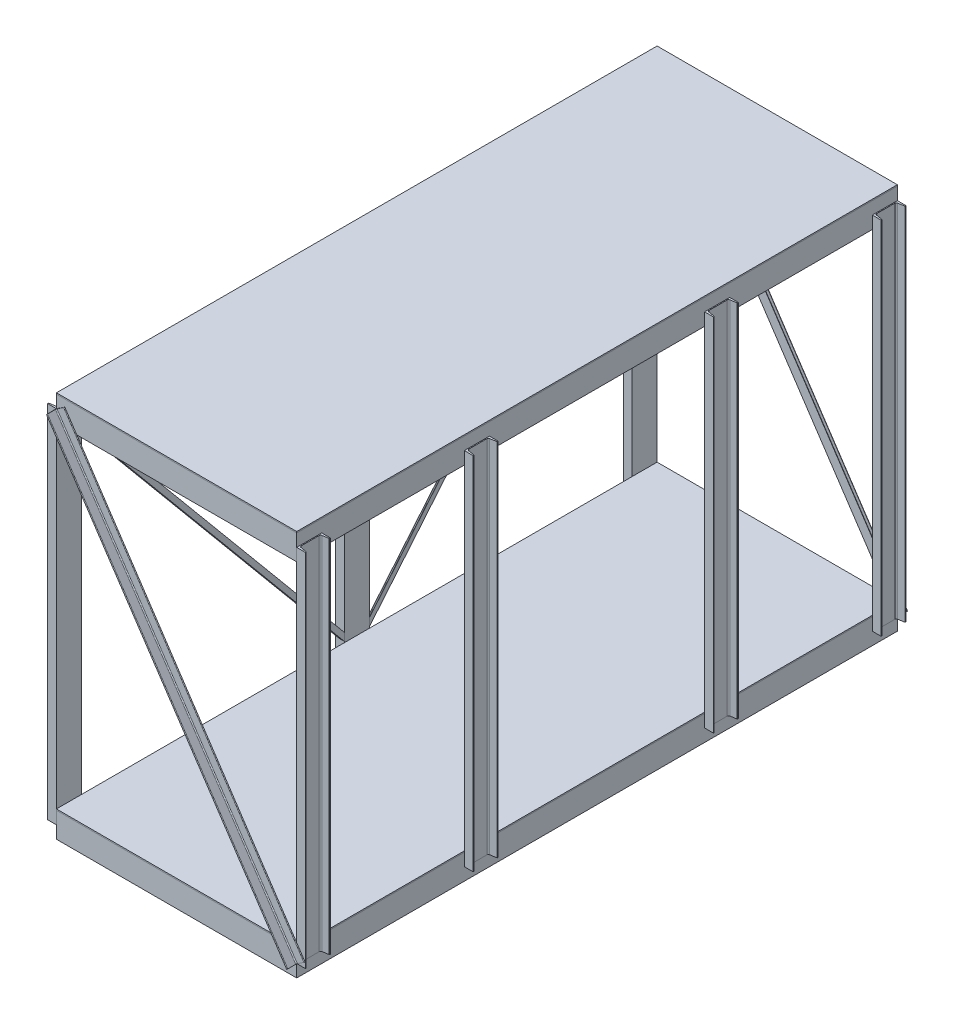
SolidWorks part; units mm, degrees
other "DetailItem53" parameters "D1"=452.3522, "D2"=250.6938, "D3"=1219.2, "D4"=1219.2
other "DetailItem54"
other "DetailItem55"
other "DetailItem56"
other "DetailItem57"
other "DetailItem58"
other "DetailItem59"
other "Grid System1" parameters "D1"=1828.8, "D2"=1828.8, "D3"=0, "D4"=0
sketch "Sketch1" plane through (0, 0, 0) normal (0, 1, 0) x (1, 0, 0)
  line L0 (0, 1524) -> (1219.2, 1524)
  line L1 (0, 0) -> (1219.2, 0)
  line L2 (0, 0) -> (0, 3048)
  line L3 (0, 3048) -> (1219.2, 3048)
  line L4 (1219.2, 0) -> (1219.2, 3048)
  line L5 (0, 2133.6) -> (1219.2, 2133.6)
  line L6 (0, 914.4) -> (1219.2, 914.4)
  point P11 (0, 1524)
  point P12 (1219.2, 1524)
  point P13 (0, 0)
  point P14 (1219.2, 0)
  point P15 (0, 3048)
  point P16 (0, 2133.6)
  point P17 (0, 914.4)
  point P18 (1219.2, 3048)
  point P19 (1219.2, 2133.6)
  point P20 (1219.2, 914.4)
ref_plane "Level1" through (0, 1828.8, 0) normal (0, 1, 0) x (1, 0, 0)
sketch "Sketch2" plane through (0, 1828.8, 0) normal (0, 1, 0) x (1, 0, 0)
  line L0 (0, 1524) -> (1219.2, 1524)
  line L1 (0, 0) -> (1219.2, 0)
  line L2 (0, 0) -> (0, 3048)
  line L3 (0, 3048) -> (1219.2, 3048)
  line L4 (1219.2, 0) -> (1219.2, 3048)
  line L5 (0, 2133.6) -> (1219.2, 2133.6)
  line L6 (0, 914.4) -> (1219.2, 914.4)
  point P11 (0, 1524)
  point P12 (1219.2, 1524)
  point P13 (0, 0)
  point P14 (1219.2, 0)
  point P15 (0, 3048)
  point P16 (0, 2133.6)
  point P17 (0, 914.4)
  point P18 (1219.2, 3048)
  point P19 (1219.2, 2133.6)
  point P20 (1219.2, 914.4)
sketch3d "3DSketch1"
  line L0 (0, 0, -1524) -> (0, 1828.8, -1524)
  line L1 (1219.2, 0, -1524) -> (1219.2, 1828.8, -1524)
  line L2 (0, 0, 0) -> (0, 1828.8, 0)
  line L3 (1219.2, 0, 0) -> (1219.2, 1828.8, 0)
  line L4 (0, 0, -3048) -> (0, 1828.8, -3048)
  line L5 (0, 0, -2133.6) -> (0, 1828.8, -2133.6)
  line L6 (0, 0, -914.4) -> (0, 1828.8, -914.4)
  line L7 (1219.2, 0, -3048) -> (1219.2, 1828.8, -3048)
  line L8 (1219.2, 0, -2133.6) -> (1219.2, 1828.8, -2133.6)
  line L9 (1219.2, 0, -914.4) -> (1219.2, 1828.8, -914.4)
surface "Surface-Extrude1" sketch "Sketch1"
ref_plane "Front Plane" through (0, 0, 0) normal (0, 0, 1) x (1, 0, 0)
ref_plane "Top Plane" through (0, 0, 0) normal (0, 1, 0) x (1, 0, 0)
ref_plane "Right Plane" through (0, 0, 0) normal (1, 0, 0) x (0, 0, -1)
other "Structural Member1"
ref_plane "Plane1" through (0, 0, 0) normal (1, 0, 0) x (0, 0, -1)
sketch "Sketch11" plane through (0, 0, 0) normal (1, 0, 0) x (0, 0, -1)
  line L0 (0, -63.5) -> (0, 63.5)
  line L1 (0, 63.5) -> (44.45, 63.5)
  line L2 (0, -63.5) -> (44.45, -63.5)
  line L6 (0, 0) -> (4.826, 0) construction
  line L12 (4.826, 45.8301) -> (4.826, -45.8301)
  line L15 (44.45, 63.5) -> (44.45, 61.0413)
  line L16 (44.45, -63.5) -> (44.45, -61.0413)
  line L17 (10.981, 53.0959) -> (42.1154, 58.2853)
  line L18 (10.981, -53.0959) -> (42.1154, -58.2853)
  arc A9 (4.826, -45.8301) -> (10.981, -53.0959) centre (12.192, -45.8301) ccw
  arc A10 (4.826, 45.8301) -> (10.981, 53.0959) centre (12.192, 45.8301) cw
  arc A11 (44.45, 61.0413) -> (42.1154, 58.2853) centre (41.656, 61.0413) cw
  arc A12 (44.45, -61.0413) -> (42.1154, -58.2853) centre (41.656, -61.0413) ccw
  point P4 (44.45, 58.6744)
  point P5 (44.45, -58.6744)
  point P6 (2.413, 0)
  point P7 (22.225, 63.5)
  point P8 (0, 0)
  point P12 (22.225, -63.5)
  dimension "D4" = 2.794
  dimension "D5" = 7.366
  dimension "D2" = 9.463
  dimension "D6" = 127
  dimension "D7" = 44.45
  dimension "D1" = 2.4587
  dimension "D3" = 4.826
other "Structural Member2"
ref_plane "Plane2" through (0, 1828.8, 0) normal (1, 0, 0) x (0, 0, -1)
sketch "Sketch12" plane through (0, 1828.8, 0) normal (1, 0, 0) x (0, 0, -1)
  line L0 (0, -63.5) -> (0, 63.5)
  line L1 (0, 63.5) -> (44.45, 63.5)
  line L2 (0, -63.5) -> (44.45, -63.5)
  line L6 (0, 0) -> (4.826, 0) construction
  line L12 (4.826, 45.8301) -> (4.826, -45.8301)
  line L15 (44.45, 63.5) -> (44.45, 61.0413)
  line L16 (44.45, -63.5) -> (44.45, -61.0413)
  line L17 (10.981, 53.0959) -> (42.1154, 58.2853)
  line L18 (10.981, -53.0959) -> (42.1154, -58.2853)
  arc A9 (4.826, -45.8301) -> (10.981, -53.0959) centre (12.192, -45.8301) ccw
  arc A10 (4.826, 45.8301) -> (10.981, 53.0959) centre (12.192, 45.8301) cw
  arc A11 (44.45, 61.0413) -> (42.1154, 58.2853) centre (41.656, 61.0413) cw
  arc A12 (44.45, -61.0413) -> (42.1154, -58.2853) centre (41.656, -61.0413) ccw
  point P4 (44.45, 58.6744)
  point P5 (44.45, -58.6744)
  point P6 (2.413, 0)
  point P7 (22.225, 63.5)
  point P8 (0, 0)
  point P12 (22.225, -63.5)
  dimension "RI" = 7.366
  dimension "D2" = 9.463
  dimension "RA" = 2.794
  dimension "Depth" = 127
  dimension "BF" = 44.45
  dimension "TW" = 4.826
  dimension "flange" = 2.4587
other "Structural Member9"
ref_plane "Plane13" through (0, 0, -2133.6) normal (0, 1, 0) x (1, 0, 0)
sketch "Sketch113" plane through (1219.2, 0, -914.4) normal (0, 1, 0) x (1, 0, 0)
  line L0 (0, -63.5) -> (0, 63.5)
  line L1 (0, 63.5) -> (44.45, 63.5)
  line L2 (0, -63.5) -> (44.45, -63.5)
  line L6 (0, 0) -> (4.826, 0) construction
  line L12 (4.826, 45.8301) -> (4.826, -45.8301)
  line L15 (44.45, 63.5) -> (44.45, 61.0413)
  line L16 (44.45, -63.5) -> (44.45, -61.0413)
  line L17 (10.981, 53.0959) -> (42.1154, 58.2853)
  line L18 (10.981, -53.0959) -> (42.1154, -58.2853)
  arc A9 (4.826, -45.8301) -> (10.981, -53.0959) centre (12.192, -45.8301) ccw
  arc A10 (4.826, 45.8301) -> (10.981, 53.0959) centre (12.192, 45.8301) cw
  arc A11 (44.45, 61.0413) -> (42.1154, 58.2853) centre (41.656, 61.0413) cw
  arc A12 (44.45, -61.0413) -> (42.1154, -58.2853) centre (41.656, -61.0413) ccw
  point P4 (44.45, 58.6744)
  point P5 (44.45, -58.6744)
  point P6 (2.413, 0)
  point P7 (22.225, 63.5)
  point P8 (0, 0)
  point P12 (22.225, -63.5)
  dimension "RI" = 7.366
  dimension "D2" = 9.463
  dimension "RA" = 2.794
  dimension "Depth" = 127
  dimension "BF" = 44.45
  dimension "TW" = 4.826
  dimension "flange" = 2.4587
other "Structural Member11"
ref_plane "Plane15"
sketch "Sketch115" plane through (0, 0, -1524) normal (0, -1, 0) x (-1, 0, 0)
  line L0 (0, -63.5) -> (0, 63.5)
  line L1 (0, 63.5) -> (44.45, 63.5)
  line L2 (0, -63.5) -> (44.45, -63.5)
  line L6 (0, 0) -> (4.826, 0) construction
  line L12 (4.826, 45.8301) -> (4.826, -45.8301)
  line L15 (44.45, 63.5) -> (44.45, 61.0413)
  line L16 (44.45, -63.5) -> (44.45, -61.0413)
  line L17 (10.981, 53.0959) -> (42.1154, 58.2853)
  line L18 (10.981, -53.0959) -> (42.1154, -58.2853)
  arc A9 (4.826, -45.8301) -> (10.981, -53.0959) centre (12.192, -45.8301) ccw
  arc A10 (4.826, 45.8301) -> (10.981, 53.0959) centre (12.192, 45.8301) cw
  arc A11 (44.45, 61.0413) -> (42.1154, 58.2853) centre (41.656, 61.0413) cw
  arc A12 (44.45, -61.0413) -> (42.1154, -58.2853) centre (41.656, -61.0413) ccw
  point P4 (44.45, 58.6744)
  point P5 (44.45, -58.6744)
  point P6 (2.413, 0)
  point P7 (22.225, 63.5)
  point P8 (0, 0)
  point P12 (22.225, -63.5)
  dimension "RI" = 7.366
  dimension "D2" = 9.463
  dimension "RA" = 2.794
  dimension "Depth" = 127
  dimension "BF" = 44.45
  dimension "TW" = 4.826
  dimension "flange" = 2.4587
other "Structural Member5"
ref_plane "Plane8" through (1219.2, 0, 0) normal (0, 1, 0) x (1, 0, 0)
sketch "Sketch18" plane through (1219.2, 0, -63.5) normal (0, 1, 0) x (1, 0, 0)
  line L0 (0, -63.5) -> (0, 63.5)
  line L1 (0, 63.5) -> (44.45, 63.5)
  line L2 (0, -63.5) -> (44.45, -63.5)
  line L6 (0, 0) -> (4.826, 0) construction
  line L12 (4.826, 45.8301) -> (4.826, -45.8301)
  line L15 (44.45, 63.5) -> (44.45, 61.0413)
  line L16 (44.45, -63.5) -> (44.45, -61.0413)
  line L17 (10.981, 53.0959) -> (42.1154, 58.2853)
  line L18 (10.981, -53.0959) -> (42.1154, -58.2853)
  arc A9 (4.826, -45.8301) -> (10.981, -53.0959) centre (12.192, -45.8301) ccw
  arc A10 (4.826, 45.8301) -> (10.981, 53.0959) centre (12.192, 45.8301) cw
  arc A11 (44.45, 61.0413) -> (42.1154, 58.2853) centre (41.656, 61.0413) cw
  arc A12 (44.45, -61.0413) -> (42.1154, -58.2853) centre (41.656, -61.0413) ccw
  point P4 (44.45, 58.6744)
  point P5 (44.45, -58.6744)
  point P6 (2.413, 0)
  point P7 (22.225, 63.5)
  point P8 (0, 0)
  point P12 (22.225, -63.5)
  dimension "RI" = 7.366
  dimension "D2" = 9.463
  dimension "RA" = 2.794
  dimension "Depth" = 127
  dimension "BF" = 44.45
  dimension "TW" = 4.826
  dimension "flange" = 2.4587
other "Structural Member6"
ref_plane "Plane10"
sketch "Sketch110" plane through (0, 0, -63.5) normal (0, -1, 0) x (-1, 0, 0)
  line L0 (0, -63.5) -> (0, 63.5)
  line L1 (0, 63.5) -> (44.45, 63.5)
  line L2 (0, -63.5) -> (44.45, -63.5)
  line L6 (0, 0) -> (4.826, 0) construction
  line L12 (4.826, 45.8301) -> (4.826, -45.8301)
  line L15 (44.45, 63.5) -> (44.45, 61.0413)
  line L16 (44.45, -63.5) -> (44.45, -61.0413)
  line L17 (10.981, 53.0959) -> (42.1154, 58.2853)
  line L18 (10.981, -53.0959) -> (42.1154, -58.2853)
  arc A9 (4.826, -45.8301) -> (10.981, -53.0959) centre (12.192, -45.8301) ccw
  arc A10 (4.826, 45.8301) -> (10.981, 53.0959) centre (12.192, 45.8301) cw
  arc A11 (44.45, 61.0413) -> (42.1154, 58.2853) centre (41.656, 61.0413) cw
  arc A12 (44.45, -61.0413) -> (42.1154, -58.2853) centre (41.656, -61.0413) ccw
  point P4 (44.45, 58.6744)
  point P5 (44.45, -58.6744)
  point P6 (2.413, 0)
  point P7 (22.225, 63.5)
  point P8 (0, 0)
  point P12 (22.225, -63.5)
  dimension "RI" = 7.366
  dimension "D2" = 9.463
  dimension "RA" = 2.794
  dimension "Depth" = 127
  dimension "BF" = 44.45
  dimension "TW" = 4.826
  dimension "flange" = 2.4587
other "Structural Member7"
ref_plane "Plane11" through (1219.2, 0, -3048) normal (0, 1, 0) x (1, 0, 0)
sketch "Sketch111" plane through (1219.2, 0, -2984.5) normal (0, 1, 0) x (1, 0, 0)
  line L0 (0, -63.5) -> (0, 63.5)
  line L1 (0, 63.5) -> (44.45, 63.5)
  line L2 (0, -63.5) -> (44.45, -63.5)
  line L6 (0, 0) -> (4.826, 0) construction
  line L12 (4.826, 45.8301) -> (4.826, -45.8301)
  line L15 (44.45, 63.5) -> (44.45, 61.0413)
  line L16 (44.45, -63.5) -> (44.45, -61.0413)
  line L17 (10.981, 53.0959) -> (42.1154, 58.2853)
  line L18 (10.981, -53.0959) -> (42.1154, -58.2853)
  arc A9 (4.826, -45.8301) -> (10.981, -53.0959) centre (12.192, -45.8301) ccw
  arc A10 (4.826, 45.8301) -> (10.981, 53.0959) centre (12.192, 45.8301) cw
  arc A11 (44.45, 61.0413) -> (42.1154, 58.2853) centre (41.656, 61.0413) cw
  arc A12 (44.45, -61.0413) -> (42.1154, -58.2853) centre (41.656, -61.0413) ccw
  point P4 (44.45, 58.6744)
  point P5 (44.45, -58.6744)
  point P6 (2.413, 0)
  point P7 (22.225, 63.5)
  point P8 (0, 0)
  point P12 (22.225, -63.5)
  dimension "RI" = 7.366
  dimension "D2" = 9.463
  dimension "RA" = 2.794
  dimension "Depth" = 127
  dimension "BF" = 44.45
  dimension "TW" = 4.826
  dimension "flange" = 2.4587
other "Structural Member8"
ref_plane "Plane12"
sketch "Sketch112" plane through (0, 0, -2984.5) normal (0, -1, 0) x (-1, 0, 0)
  line L0 (0, -63.5) -> (0, 63.5)
  line L1 (0, 63.5) -> (44.45, 63.5)
  line L2 (0, -63.5) -> (44.45, -63.5)
  line L6 (0, 0) -> (4.826, 0) construction
  line L12 (4.826, 45.8301) -> (4.826, -45.8301)
  line L15 (44.45, 63.5) -> (44.45, 61.0413)
  line L16 (44.45, -63.5) -> (44.45, -61.0413)
  line L17 (10.981, 53.0959) -> (42.1154, 58.2853)
  line L18 (10.981, -53.0959) -> (42.1154, -58.2853)
  arc A9 (4.826, -45.8301) -> (10.981, -53.0959) centre (12.192, -45.8301) ccw
  arc A10 (4.826, 45.8301) -> (10.981, 53.0959) centre (12.192, 45.8301) cw
  arc A11 (44.45, 61.0413) -> (42.1154, 58.2853) centre (41.656, 61.0413) cw
  arc A12 (44.45, -61.0413) -> (42.1154, -58.2853) centre (41.656, -61.0413) ccw
  point P4 (44.45, 58.6744)
  point P5 (44.45, -58.6744)
  point P6 (2.413, 0)
  point P7 (22.225, 63.5)
  point P8 (0, 0)
  point P12 (22.225, -63.5)
  dimension "RI" = 7.366
  dimension "D2" = 9.463
  dimension "RA" = 2.794
  dimension "Depth" = 127
  dimension "BF" = 44.45
  dimension "TW" = 4.826
  dimension "flange" = 2.4587
sketch "Sketch116" plane through (0, 0, 0) normal (0, 0, 1) x (1, 0, 0)
  line L0 (0, 1828.8) -> (1219.2, 0)
other "Structural Member12"
ref_plane "Plane16" through (0, 1828.8, 0) normal (0.5547, -0.8321, 0) x (0.8321, 0.5547, 0)
sketch "Sketch119" plane through (0, 1828.8, 0) normal (0.5547, -0.8321, 0) x (0.8321, 0.5547, 0)
  line L0 (0, 0) -> (0, 50.8)
  line L1 (0, 50.8) -> (0.0051, 50.8)
  line L2 (3.175, 47.6301) -> (3.175, 7.9375)
  line L3 (7.9375, 3.175) -> (47.6301, 3.175)
  line L4 (50.8, 0.0051) -> (50.8, 0)
  line L5 (50.8, 0) -> (0, 0)
  arc A0 (50.8, 0.0051) -> (47.6301, 3.175) centre (47.6301, 0.0051) ccw
  arc A1 (0.0051, 50.8) -> (3.175, 47.6301) centre (0.0051, 47.6301) cw
  arc A2 (7.9375, 3.175) -> (3.175, 7.9375) centre (7.9375, 7.9375) cw
  point P10 (25.4, 0)
  point P14 (0, 25.4)
  point P15 (3.175, 25.4)
  point P16 (25.4, 3.175)
  point P17 (3.175, 50.8)
  point P18 (50.8, 3.175)
  point P19 (0, 0)
  dimension "D2" = 0.0051
  dimension "Radius_1" = 4.7625
  dimension "D1" = 3.175
  dimension "H_leg" = 50.8
mirror "Mirror1" about plane through (0, 0, -1524) normal (0, 0, 1)
sketch "Sketch120" plane through (0, 0, 0) normal (-1, 0, 0) x (0, 0, 1)
  line L0 (-3048, 1828.8) -> (-1524, 0)
  line L1 (-3048, 0) -> (-3048, 1828.8) construction
  line L2 (-1524, 0) -> (0, 1828.8)
  line L3 (-3048, 1765.3) -> (-3048, 1892.3) construction
other "Structural Member13"
ref_plane "Plane17" through (0, 1828.8, -3048) normal (0, -0.7682, 0.6402) x (0, 0.6402, 0.7682)
sketch "Sketch127" plane through (0, 1828.8, -3048) normal (0, -0.7682, 0.6402) x (0, 0.6402, 0.7682)
  line L0 (0, 0) -> (0, 25.4)
  line L1 (0, 25.4) -> (0.0051, 25.4)
  line L2 (3.175, 22.2301) -> (3.175, 7.9375)
  line L3 (7.9375, 3.175) -> (22.2301, 3.175)
  line L4 (25.4, 0.0051) -> (25.4, 0)
  line L5 (25.4, 0) -> (0, 0)
  arc A0 (25.4, 0.0051) -> (22.2301, 3.175) centre (22.2301, 0.0051) ccw
  arc A1 (0.0051, 25.4) -> (3.175, 22.2301) centre (0.0051, 22.2301) cw
  arc A2 (7.9375, 3.175) -> (3.175, 7.9375) centre (7.9375, 7.9375) cw
  point P10 (12.7, 0)
  point P14 (0, 12.7)
  point P15 (3.175, 12.7)
  point P16 (12.7, 3.175)
  point P17 (3.175, 25.4)
  point P18 (25.4, 3.175)
  point P19 (0, 0)
  dimension "D2" = 0.0051
  dimension "Radius_1" = 4.7625
  dimension "D1" = 3.175
  dimension "H_leg" = 25.4
other "Trim/Extend2"
other "Trim/Extend3"
sketch "Sketch129" plane through (0, 1892.3, 0) normal (0, 1, 0) x (1, 0, 0)
  line L1 (0, 3048) -> (1219.2, 3048)
  line L2 (0, 3048) -> (0, 0)
  line L3 (0, 0) -> (1219.2, 0)
  line L4 (1219.2, 3048) -> (1219.2, 0)
extrude "Boss-Extrude1" add sketch "Sketch129" along normal blind 6.35 separate body
pattern_linear "LPattern1" count 2 spacing 1828.8 along (0, -1, 0)
